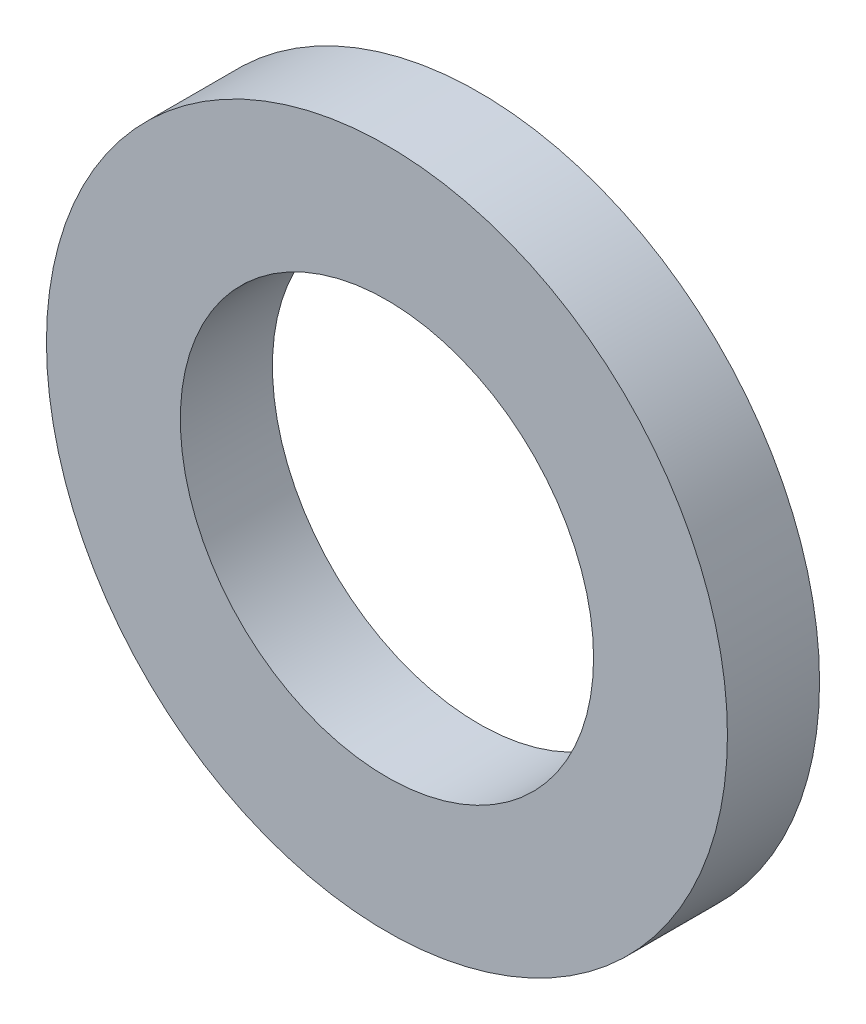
SolidWorks part; units mm, degrees
ref_plane "Front" through (0, 0, 0) normal (0, 0, 1) x (1, 0, 0)
ref_plane "Top" through (0, 0, 0) normal (0, 1, 0) x (1, 0, 0)
ref_plane "Right" through (0, 0, 0) normal (1, 0, 0) x (0, 0, -1)
sketch "Sketch1" plane through (0, 0, 0) normal (0, 0, 1) x (1, 0, 0)
  circle A0 centre (0, 0) radius 3.365
  circle A1 centre (0, 0) radius 5.545
  dimension "D1" = 6.73
  dimension "D2" = 2.18
extrude "Base-Extrude" add sketch "Sketch1" along normal blind 1.5
